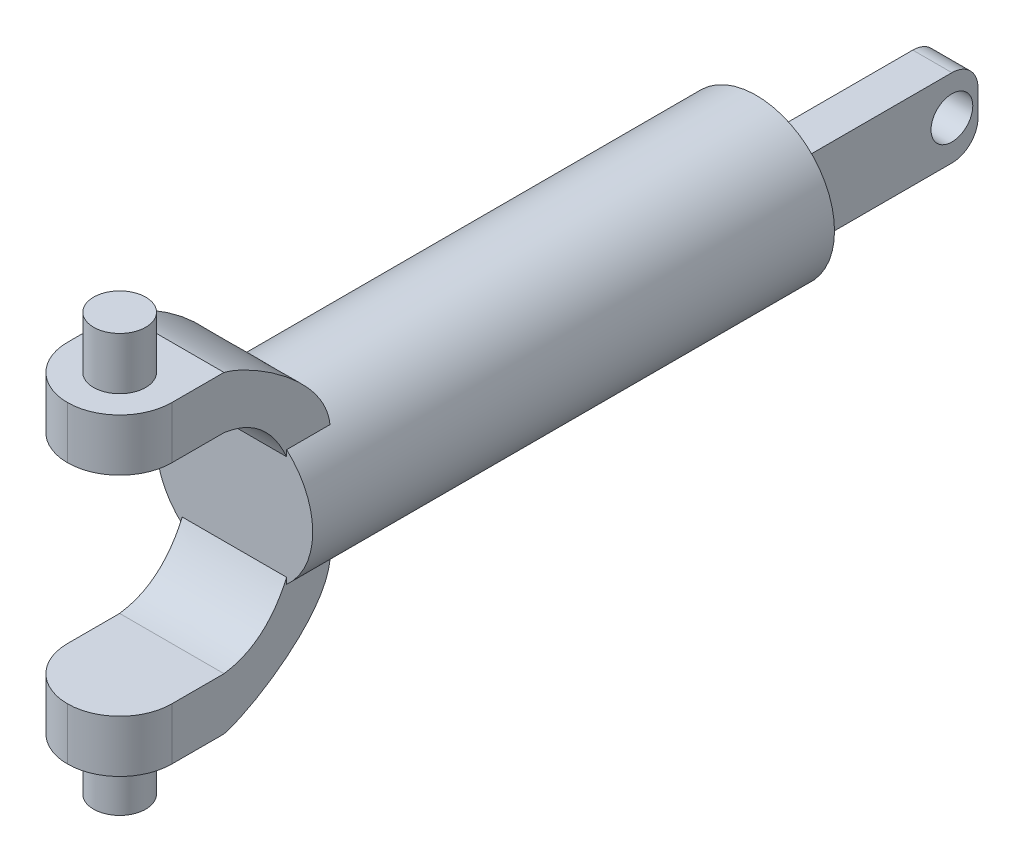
SolidWorks part; units mm, degrees
ref_plane "Front Plane" through (0, 0, 0) normal (0, 0, 1) x (1, 0, 0)
ref_plane "Top Plane" through (0, 0, 0) normal (0, 1, 0) x (1, 0, 0)
ref_plane "Right Plane" through (0, 0, 0) normal (1, 0, 0) x (0, 0, -1)
sketch "Sketch1" plane through (0, 0, 0) normal (1, 0, 0) x (0, 0, -1)
  line L0 (0, -100) -> (0, 100) construction
  line L1 (0, 100) -> (-100, 100)
  line L2 (-100, 100) -> (-100, 150)
  line L3 (-100, 150) -> (0, 150)
  line L4 (0, 0) -> (60, 0) construction
  line L5 (60, -50) -> (60, 50)
  line L6 (0, 100) -> (40.2562, 94.4943) construction
  line L7 (40.2562, 94.4943) -> (60, 50) construction
  line L8 (60, 0) -> (101.7666, 0)
  line L9 (101.7666, -50) -> (101.7666, 50)
  line L10 (101.7666, 50) -> (103.3791, 96.3577) construction
  line L11 (103.3791, 96.3577) -> (27.036, 143.3468) construction
  line L12 (27.036, 143.3468) -> (0, 150) construction
  line L13 (101.7666, -50) -> (103.3791, -96.3577) construction
  line L14 (103.3791, -96.3577) -> (27.036, -143.3468) construction
  line L15 (27.036, -143.3468) -> (0, -150) construction
  line L16 (0, -100) -> (40.2562, -94.4943) construction
  line L17 (40.2562, -94.4943) -> (60, -50) construction
  line L18 (-100, -150) -> (0, -150)
  line L19 (-100, -100) -> (-100, -150)
  line L20 (0, -100) -> (-100, -100)
  spline S0 degree 2 poles (0, 100) (40.2562, 94.4943) (60, 50) knots 0 0 0 1 1 1
  spline S1 degree 3 poles (101.7666, 50) (103.3791, 96.3577) (27.036, 143.3468) (0, 150) knots 0 0 0 0 1 1 1 1
  spline S2 degree 3 poles (101.7666, -50) (103.3791, -96.3577) (27.036, -143.3468) (0, -150) knots 0 0 0 0 1 1 1 1
  spline S3 degree 2 poles (0, -100) (40.2562, -94.4943) (60, -50) knots 0 0 0 1 1 1
  dimension "D1" = 50
  dimension "D2" = 100
  dimension "D3" = 100
  dimension "D4" = 100
  dimension "D5" = 50
  dimension "D6" = 60
extrude "Boss-Extrude1" add sketch "Sketch1" along normal mid plane 100 contours L9 S1 L3 L2 L1 S0 L5 L8 | S3 L20 L19 L18 S2 L9 L8 L5
fillet "Fillet1" radius 50 4 edges at (-50, -125, 100) (50, -125, 100) (-50, 125, 100) (50, 125, 100)
sketch "Sketch2" plane through (0, -150, 0) normal (0, -1, 0) x (1, 0, 0)
  circle A0 centre (0, 50) radius 25
extrude "Boss-Extrude2" add sketch "Sketch2" along normal blind 50
sketch "Sketch3" plane through (0, 150, 0) normal (0, 1, 0) x (1, 0, 0)
  circle A0 centre (0, -50) radius 25
extrude "Boss-Extrude3" add sketch "Sketch3" along normal blind 50
sketch "Sketch4" plane through (0, 0, -60) normal (0, 0, 1) x (1, 0, 0)
  circle A0 centre (0, 0) radius 75
extrude "Boss-Extrude4" add sketch "Sketch4" against normal blind 500
sketch "Sketch5" plane through (0, 0, -560) normal (0, 0, -1) x (-1, 0, 0)
  line L0 (0, 37.5) -> (0, -37.5)
  line L1 (-37.5, -37.5) -> (0, -37.5)
  line L2 (-37.5, -37.5) -> (-37.5, 37.5)
  line L3 (-37.5, 37.5) -> (0, 37.5)
  line L5 (-37.5, -37.5) -> (0, 0) construction
  line L6 (-37.5, 37.5) -> (0, 0) construction
  point P0 (0, 0)
  dimension "D2" = 75
extrude "Boss-Extrude5" add sketch "Sketch5" along normal blind 175
sketch "Sketch6" plane through (37.5, 0, 0) normal (1, 0, 0) x (0, 0, -1)
  line L0 (735, 0) -> (710, 0) construction
  line L1 (735, 37.5) -> (735, -37.5) construction
  circle A0 centre (710, 0) radius 20
extrude "Cut-Extrude1" cut sketch "Sketch6" against normal through all both
fillet "Fillet2" radius 25 2 edges at (18.75, -37.5, -735) (18.75, 37.5, -735)
